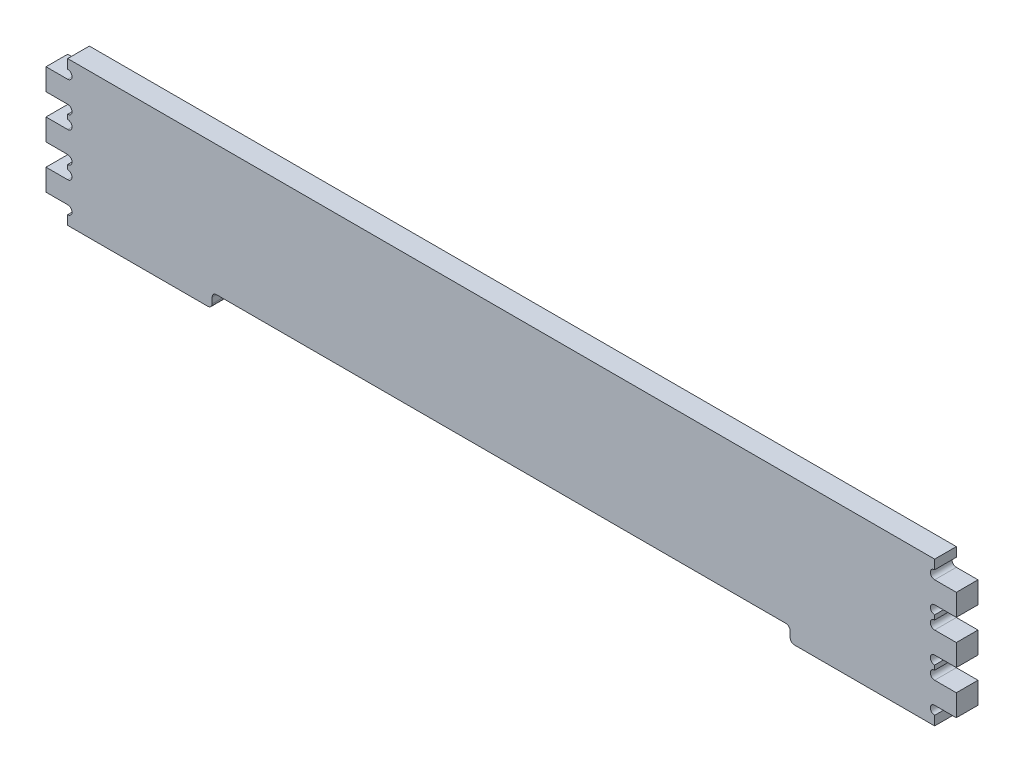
SolidWorks part; units mm, degrees
ref_plane "Ebene vorne" through (0, 0, 0) normal (0, 0, 1) x (1, 0, 0)
ref_plane "Ebene oben" through (0, 0, 0) normal (0, 1, 0) x (1, 0, 0)
ref_plane "Ebene rechts" through (0, 0, 0) normal (1, 0, 0) x (0, 0, -1)
sketch "Skizze1" plane through (0, 0, 0) normal (0, 0, 1) x (1, 0, 0)
  line L0 (-15, 12.4) -> (0, 12.4)
  line L1 (0, 6.4) -> (0, 0)
  line L2 (-15, 12.4) -> (-15, 27.4)
  line L3 (0, 27.4) -> (-15, 27.4)
  line L4 (0, 33.4) -> (0, 36.5)
  line L5 (0, 42.5) -> (-15, 42.5)
  line L6 (-15, 42.5) -> (-15, 57.5)
  line L7 (-15, 57.5) -> (0, 57.5)
  line L8 (0, 63.5) -> (0, 66.6)
  line L9 (0, 72.6) -> (-15, 72.6)
  line L10 (-15, 72.6) -> (-15, 87.6)
  line L11 (-15, 87.6) -> (0, 87.6)
  line L12 (0, 93.6) -> (0, 100)
  line L13 (0, 100) -> (600, 100)
  line L14 (600, 100) -> (600, 93.6)
  line L15 (600, 87.6) -> (615, 87.6)
  line L16 (615, 87.6) -> (615, 72.6)
  line L17 (615, 72.6) -> (600, 72.6)
  line L18 (600, 66.6) -> (600, 63.5)
  line L19 (600, 57.5) -> (615, 57.5)
  line L20 (615, 57.5) -> (615, 42.5)
  line L21 (615, 42.5) -> (600, 42.5)
  line L22 (600, 36.5) -> (600, 33.4)
  line L23 (600, 27.4) -> (615, 27.4)
  line L24 (615, 27.4) -> (615, 12.4)
  line L25 (615, 12.4) -> (600, 12.4)
  line L26 (600, 6.4) -> (600, 0)
  line L27 (600, 0) -> (500, 0)
  line L28 (500, 0) -> (500, 10)
  line L29 (500, 10) -> (100, 10)
  line L30 (100, 10) -> (100, 0)
  line L31 (100, 0) -> (0, 0)
  arc A0 (0, 36.5) -> (0, 42.5) centre (0, 39.5) ccw
  arc A1 (0, 27.4) -> (0, 33.4) centre (0, 30.4) ccw
  arc A2 (0, 12.4) -> (0, 6.4) centre (0, 9.4) cw
  arc A3 (0, 72.6) -> (0, 66.6) centre (0, 69.6) cw
  arc A4 (0, 63.5) -> (0, 57.5) centre (0, 60.5) cw
  arc A5 (0, 93.6) -> (0, 87.6) centre (0, 90.6) cw
  arc A6 (600, 6.4) -> (600, 12.4) centre (600, 9.4) cw
  arc A7 (600, 27.4) -> (600, 33.4) centre (600, 30.4) cw
  arc A8 (600, 36.5) -> (600, 42.5) centre (600, 39.5) cw
  arc A9 (600, 57.5) -> (600, 63.5) centre (600, 60.5) cw
  arc A10 (600, 66.6) -> (600, 72.6) centre (600, 69.6) cw
  arc A11 (600, 87.6) -> (600, 93.6) centre (600, 90.6) cw
  dimension "D20" = 15
  dimension "D21" = 15
  dimension "D22" = 15
  dimension "D23" = 6
  dimension "D24" = 6
  dimension "D25" = 6
  dimension "D15" = 15
  dimension "D2" = 15
  dimension "D3" = 15
  dimension "D4" = 15
  dimension "D5" = 100
  dimension "D6" = 15
  dimension "D7" = 400
  dimension "D8" = 100
  dimension "D9" = 10
  dimension "D10" = 15
  dimension "D11" = 15.1
  dimension "D12" = 15
  dimension "D13" = 15.1
  dimension "D14" = 15
  dimension "D16" = 600
  dimension "D17" = 600
  dimension "D18" = 15
  dimension "D19" = 15
  dimension "D26" = 6
  dimension "D27" = 6
  dimension "D28" = 6
  dimension "D29" = 15
  dimension "D30" = 15
  dimension "D31" = 15
  dimension "D32" = 15
  dimension "D33" = 15
  dimension "D34" = 6
  dimension "D35" = 6
  dimension "D36" = 6
  dimension "D37" = 6
  dimension "D38" = 15
  dimension "D39" = 6
  dimension "D40" = 6
  dimension "D41" = 6.4
extrude "Aufsatz-Linear austragen1" add sketch "Skizze1" along normal blind 15 contours L13 L14 A11 L15 L16 L17 A10 L18 A9 L19 L20 L21 A8 L22 A7 L23 L24 L25 A6 L26 L27 L28 L29 L30 L31 L1 A2 L0 L2 L3 A1 L4 A0 L5 L6 L7 A4 L8 A3 L9 L10 L11 A5 L12
fillet "Verrundung1" radius 3 4 edges at (500, 0, 7.5) (500, 10, 7.5) (100, 10, 7.5) (100, 0, 7.5)
